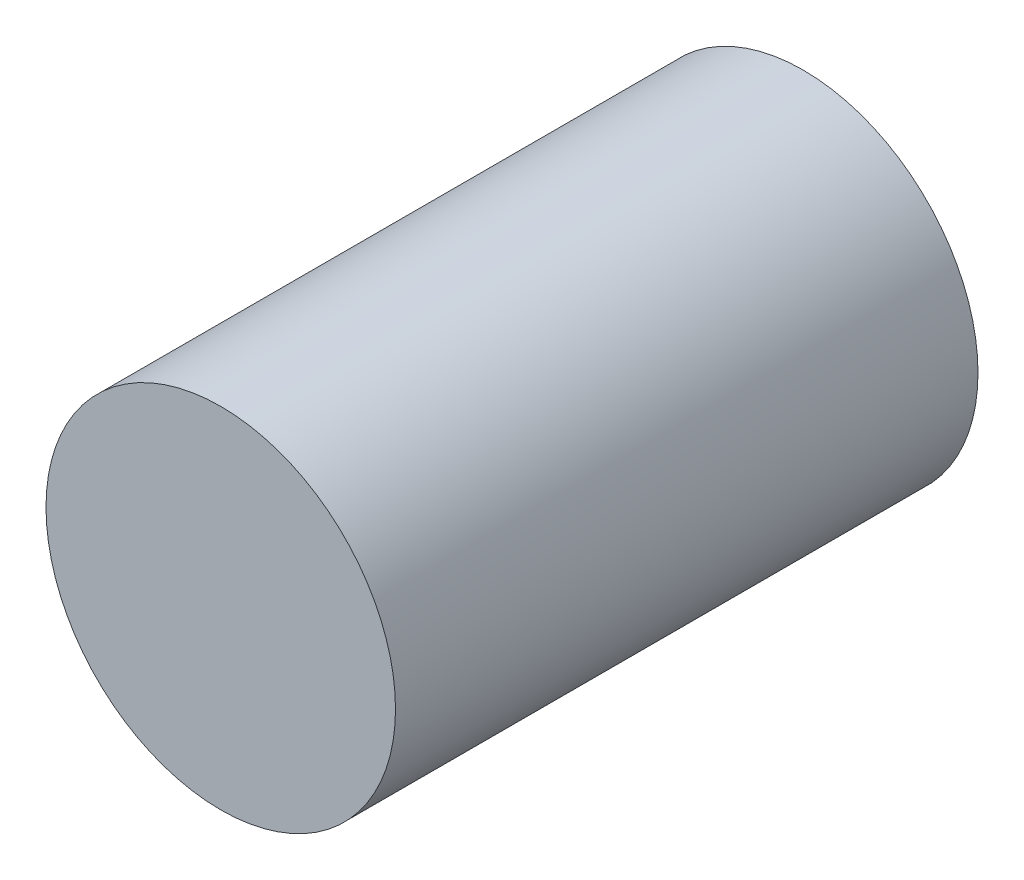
SolidWorks part; units mm, degrees
ref_plane "Front Plane" through (0, 0, 0) normal (0, 0, 1) x (1, 0, 0)
ref_plane "Top Plane" through (0, 0, 0) normal (0, 1, 0) x (1, 0, 0)
ref_plane "Right Plane" through (0, 0, 0) normal (1, 0, 0) x (0, 0, -1)
sketch "Sketch1" plane through (0, 0, 0) normal (0, 0, 1) x (1, 0, 0)
  circle A0 centre (0, 0) radius 30
  dimension "D1" = 60
extrude "Boss-Extrude1" add sketch "Sketch1" against normal blind 100
